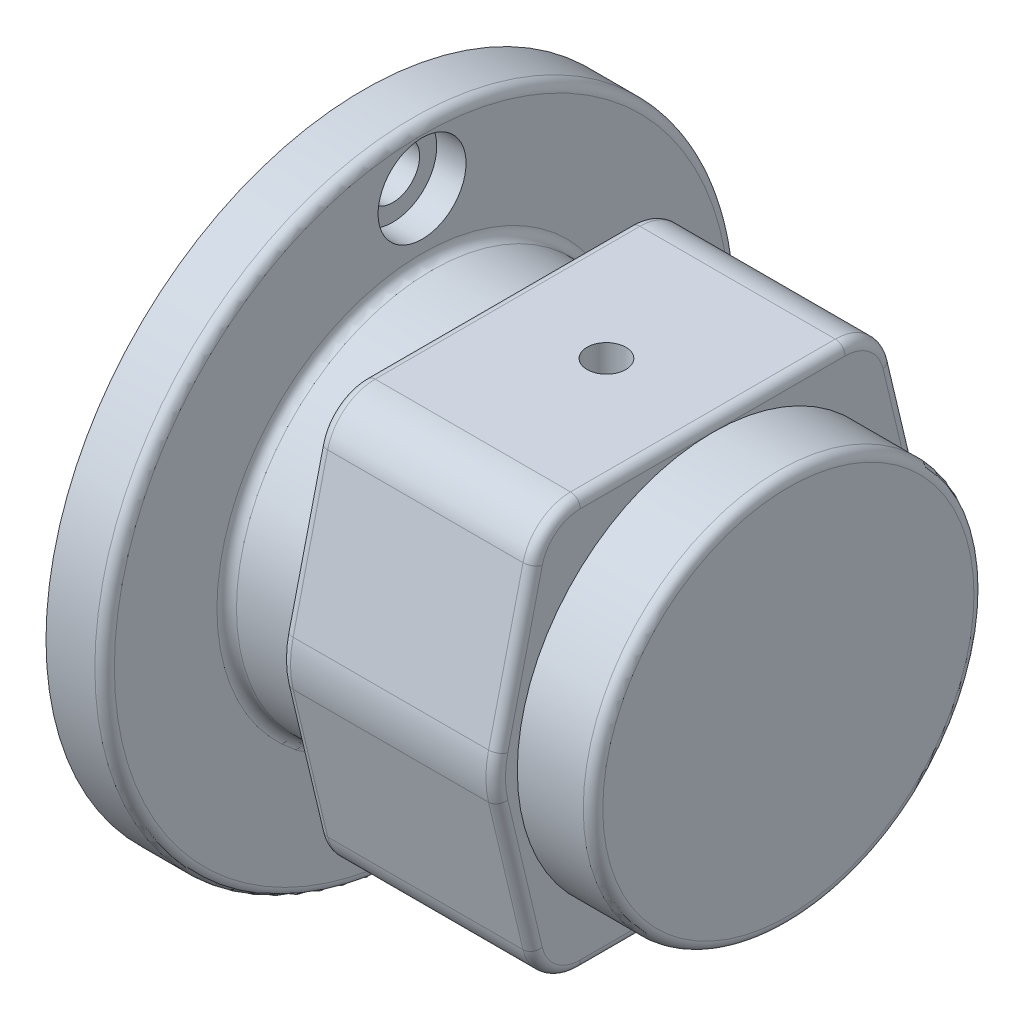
SolidWorks part; units mm, degrees
ref_plane "Plan de face" through (0, 0, 0) normal (0, 0, 1) x (1, 0, 0)
ref_plane "Plan de dessus" through (0, 0, 0) normal (0, 1, 0) x (1, 0, 0)
ref_plane "Plan de droite" through (0, 0, 0) normal (1, 0, 0) x (0, 0, -1)
sketch "Esquisse1" plane through (0, 0, 0) normal (0, 0, 1) x (1, 0, 0)
  line L0 (0, 0) -> (107.4723, 0) construction
  line L1 (0, 0) -> (0, 32.5)
  line L2 (0, 65) -> (12, 65)
  line L3 (12, 65) -> (12, 40)
  line L4 (12, 40) -> (87, 40)
  line L5 (87, 40) -> (87, 0)
  line L6 (87, 0) -> (0, 0)
  line L7 (0, 40) -> (-6, 40)
  line L8 (-6, 40) -> (-6, 32.5)
  line L9 (-6, 32.5) -> (0, 32.5)
  line L10 (0, 40) -> (0, 65)
  dimension "D1" = 65
  dimension "D2" = 12
  dimension "D3" = 75
  dimension "D4" = 40
  dimension "D5" = 6
  dimension "D6" = 40
  dimension "D7" = 32.5
revolve "Révolution1" add sketch "Esquisse1" angle 360 about L0
ref_plane "Plan1" through (49.5, 0, 0) normal (-1, 0, 0) x (0, 0, 1)
sketch "Esquisse2" plane through (49.5, 0, 0) normal (-1, 0, 0) x (0, 0, 1)
  line L0 (-89.6111, 0) -> (93.1172, 0) construction
  line L1 (-27.1014, 42) -> (27.1014, 42)
  line L2 (36.8295, 34.3162) -> (43.897, 4.6324)
  line L3 (-36.8295, 34.3162) -> (-43.897, 4.6324)
  line L4 (-36.8295, -34.3162) -> (-43.897, -4.6324)
  line L5 (-27.1014, -42) -> (27.1014, -42)
  line L6 (36.8295, -34.3162) -> (43.897, -4.6324)
  circle A0 centre (0, 0) radius 40 construction
  arc A1 (-36.8295, 34.3162) -> (-27.1014, 42) centre (-27.1014, 32) cw
  arc A2 (36.8295, 34.3162) -> (27.1014, 42) centre (27.1014, 32) ccw
  arc A3 (-36.8295, -34.3162) -> (-27.1014, -42) centre (-27.1014, -32) ccw
  arc A4 (36.8295, -34.3162) -> (27.1014, -42) centre (27.1014, -32) cw
  arc A5 (-43.897, -4.6324) -> (-43.897, 4.6324) centre (-24.4409, 0) cw
  arc A6 (43.897, -4.6324) -> (43.897, 4.6324) centre (24.4409, 0) ccw
  point P11 (-35, 42)
  point P14 (35, 42)
  point P23 (-45, 0)
  point P26 (45, 0)
  dimension "D1" = 80
  dimension "D7" = 10
  dimension "D8" = 20
  dimension "D9" = 20
  dimension "D2" = 42
  dimension "D3" = 35
  dimension "D4" = 45
  dimension "D5" = 45
  dimension "D6" = 35
extrude "Extrusion1" add sketch "Esquisse2" along normal blind 22 and the other way blind 22
fillet "Congé1" radius 2 27 edges at (27.5, 39.8474, 33.2997) (27.5, 19.4743, 40.3633) (27.5, 0, 44.4409) (27.5, -19.4743, 40.3633) (27.5, -39.8474, 33.2997) (27.5, -42, 0) (27.5, -39.8474, -33.2997) (27.5, -19.4743, -40.3633) (27.5, 0, -44.4409) (27.5, 19.4743, -40.3633) (27.5, 39.8474, -33.2997) (71.5, 39.8474, 33.2997) (71.5, 19.4743, 40.3633) (71.5, 0, 44.4409) (71.5, -19.4743, 40.3633) (71.5, -39.8474, 33.2997) (71.5, -42, 0) (71.5, -39.8474, -33.2997) (71.5, -19.4743, -40.3633) (71.5, 0, -44.4409) (71.5, 19.4743, -40.3633) (71.5, 39.8474, -33.2997) (12, 0, 40) (12, 0, 65) (27.5, 42, 0) (71.5, 42, 0) (87, 0, 40)
hole_wizard "Chambrage pour vis à tête ronde bombée M51" positions "Esquisse5" profile "Esquisse4" counterbore size "M5" standard "Ansi Métrique"
sketch "Esquisse5" plane through (12, 0, 0) normal (1, 0, 0) x (0, 0, -1)
  line L0 (0, 0) -> (0, 70.4027) construction
  point P0 (0, 53.5)
  dimension "D1" = 53.5
sketch "Esquisse4" plane through (12, 53.5, 0) normal (0, 1, 0) x (0, 0, -1)
  line L0 (0, 0) -> (0, 18)
  line L1 (0, 18) -> (5.5, 18)
  line L3 (5.5, 18) -> (5.5, 6)
  line L4 (5.5, 6) -> (9, 6)
  line L5 (9, 6) -> (9, 0)
  line L7 (9, 0) -> (0, 0)
  line L11 (0, -6.35) -> (0, 107.95) construction
  dimension "Diamètre du perçage jusqu'au prochain" = 11
  dimension "Profondeur du perçage jusqu'au prochain" = 18
  dimension "Diamètre du chambrage" = 18
  dimension "Profondeur du chambrage" = 6
pattern_circular "Répétition circulaire1" count 2 every 180 about axis through (0, 0, 0) along (1, 0, 0) of "Chambrage pour vis à tête ronde bombée M51"
hole_wizard "Trou taraudé 3/8-161" positions "Esquisse3D1" profile "Esquisse7" tap size "3/8-16" standard "PCS"
sketch3d "Esquisse3D1"
  point P0 (49.5, 42, -0.2466)
sketch "Esquisse7" plane through (49.5, 42, -0.2466) normal (1, 0, 0) x (0, 0, 1)
  line L0 (0, 0) -> (0, 107)
  line L1 (0, 107) -> (3.9687, 107)
  line L2 (3.9687, 107) -> (3.9687, 0)
  line L5 (3.9687, 0) -> (0, 0)
  line L11 (0, -6.35) -> (0, 107.95) construction
  dimension "Diamètre du trou pour taraudage jusqu'au prochain" = 7.9375
  dimension "Profondeur du trou pour taraudage jusqu'au prochain" = 107
chamfer "Chanfrein1" distance 1 angle 45 1 edges at (-6, 0, 40)
